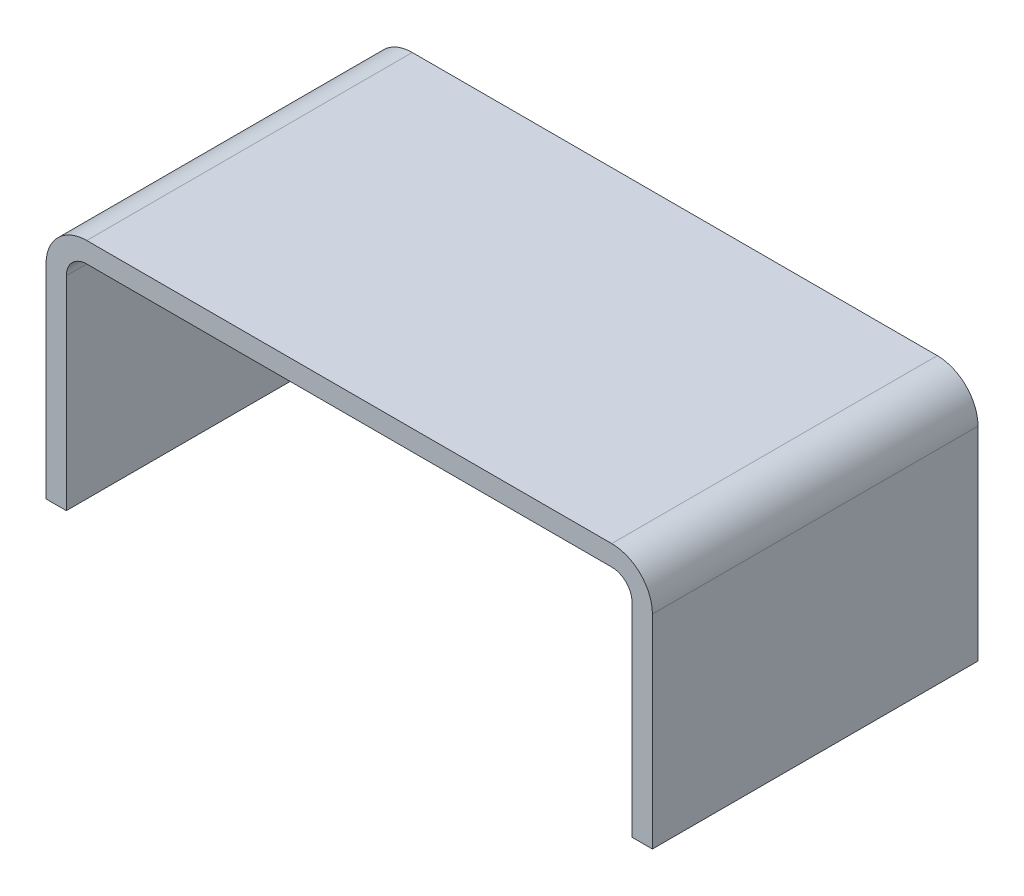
SolidWorks part; units mm, degrees
ref_plane "Face" through (0, 0, 0) normal (0, 0, 1) x (1, 0, 0)
ref_plane "Dessus" through (0, 0, 0) normal (0, 1, 0) x (1, 0, 0)
ref_plane "Droite" through (0, 0, 0) normal (1, 0, 0) x (0, 0, -1)
sketch "Esquisse1" plane through (0, 0, 0) normal (0, 0, 1) x (1, 0, 0)
  line L0 (144, 0) -> (149, 0)
  line L1 (0, 0) -> (5, 0)
  line L2 (0, 0) -> (0, 50)
  line L3 (10, 60) -> (139, 60)
  line L4 (149, 0) -> (149, 50)
  line L6 (5, 0) -> (5, 50)
  line L7 (10, 55) -> (139, 55)
  line L8 (144, 0) -> (144, 50)
  arc A0 (0, 50) -> (10, 60) centre (10, 50) cw
  arc A1 (139, 60) -> (149, 50) centre (139, 50) cw
  arc A2 (5, 50) -> (10, 55) centre (10, 50) cw
  arc A3 (139, 55) -> (144, 50) centre (139, 50) cw
  point P10 (0, 60)
  point P13 (149, 60)
  dimension "D6" = 10
  dimension "D7" = 5
  dimension "D1" = 149
  dimension "D2" = 5
  dimension "D3" = 5
  dimension "D4" = 5
  dimension "D5" = 60
extrude "Base-Extrusion" add sketch "Esquisse1" along normal blind 1000
sketch "Esquisse2" plane through (0, 60, 0) normal (0, 1, 0) x (-1, 0, 0)
  line L0 (-139, 1000) -> (-10, 1000) construction
  line L1 (60, 920) -> (-240, 920)
  line L2 (60, 920) -> (60, -120)
  line L3 (60, -120) -> (-240, -120)
  line L4 (-240, 920) -> (-240, -120)
  dimension "D1" = 80
extrude "Enlèv. mat.-Extru.1" cut sketch "Esquisse2" against normal through all
